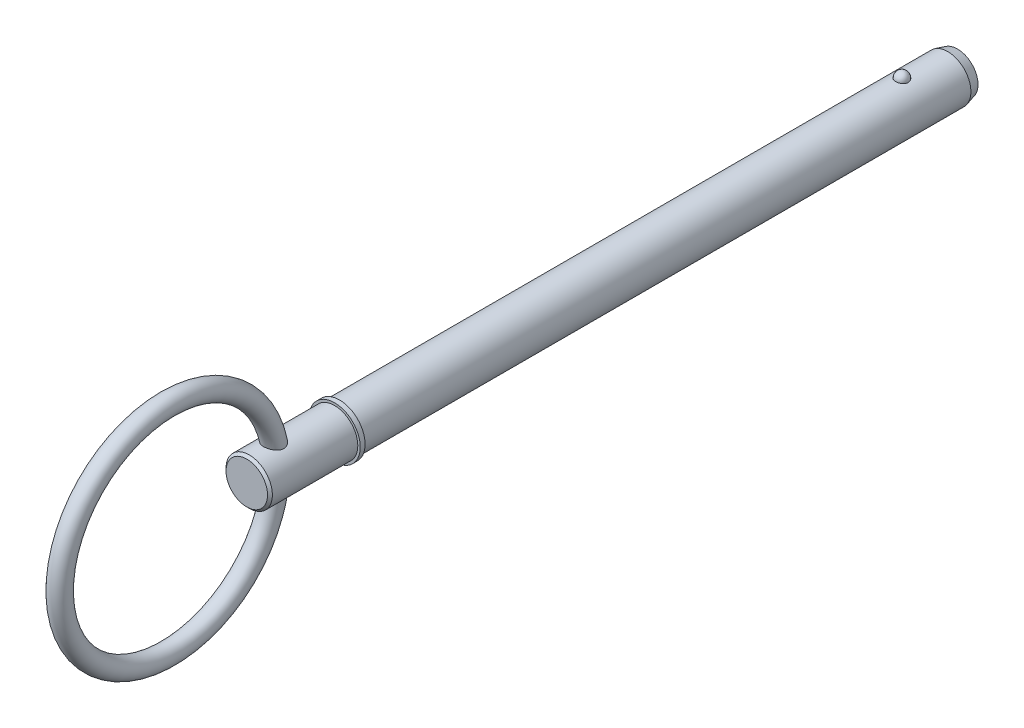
SolidWorks part; units mm, degrees
ref_plane "Front Plane" through (0, 0, 0) normal (0, 0, 1) x (1, 0, 0)
ref_plane "Top Plane" through (0, 0, 0) normal (0, 1, 0) x (1, 0, 0)
ref_plane "Right Plane" through (0, 0, 0) normal (1, 0, 0) x (0, 0, -1)
sketch "Sketch2" plane through (0, 0, 0) normal (0, 0, 1) x (1, 0, 0)
  circle A0 centre (0, 0) radius 4.765
  point P3 (0, 4.765)
  dimension "D1" = 9.53
extrude "Boss-Extrude1" add sketch "Sketch2" along normal blind 114.3
sketch "Sketch3" plane through (0, 0, 0) normal (0, 0, -1) x (-1, 0, 0)
  circle A0 centre (0, 0) radius 4.765
  dimension "D1" = 9.53
extrude "Boss-Extrude2" add sketch "Sketch3" along normal blind 12.7
chamfer "Chamfer1" distance 2 angle 15 1 edges at (-4.765, 0, -12.7)
sketch "Sketch18" plane through (0, 0, 0) normal (1, 0, 0) x (0, 0, -1)
  line L0 (10.7, 4.765) -> (-114.3, 4.765) construction
  line L1 (1.29, 6.055) -> (1.29, 3.475)
  line L2 (-114.3, -4.765) -> (10.7, -4.765) construction
  arc A0 (1.29, 6.055) -> (1.29, 3.475) centre (1.29, 4.765) ccw
  point P4 (0, 4.765)
  dimension "D1" = 10.82
revolve "Revolve1" add sketch "Sketch18" angle 360 about L1
sketch "Sketch19" plane through (0, 0, 0) normal (1, 0, 0) x (0, 0, -1)
  line L0 (-33.7288, 0) -> (-46.4542, 0) construction
sketch "Sketch20" plane through (0, 0, 0) normal (1, 0, 0) x (0, 0, -1)
  line L0 (-114.3, 0) -> (-114.3, 5.265)
  line L1 (-114.3, 4.765) -> (-114.3, -4.765) construction
  line L2 (-114.3, 5.265) -> (-115.3, 5.265)
  line L3 (-115.3, 5.265) -> (-115.3, 0)
  line L4 (-33.7288, 0) -> (-46.4542, 0) construction
  line L5 (-115.3, 0) -> (-114.3, 0)
  dimension "D1" = 5.265
  dimension "D2" = 1
revolve "Revolve2" add sketch "Sketch20" angle 360 about L0
sketch "Sketch21" plane through (0, 0, 114.3) normal (0, 0, -1) x (-1, 0, 0)
  circle A0 centre (0, 0) radius 4.765
  dimension "D1" = 9.53
extrude "Boss-Extrude3" add sketch "Sketch21" against normal blind 19.05
chamfer "Chamfer2" distance 0.5 angle 45 1 edges at (-4.765, 0, 133.35)
sketch "Sketch23" plane through (0, 0, 0) normal (1, 0, 0) x (0, 0, -1)
  line L0 (-133.35, 4.265) -> (-133.35, -4.265) construction
  circle A0 centre (-149.575, 0) radius 22.225
  point P2 (-127.35, 0)
  dimension "D1" = 44.45
  dimension "D2" = 6
sketch "Sketch24" plane through (0, 0, 0) normal (0, 1, 0) x (1, 0, 0)
  circle A0 centre (0, -127.35) radius 2
  dimension "D1" = 4
sweep "Sweep1" add profiles "Sketch24" path "Sketch23"
